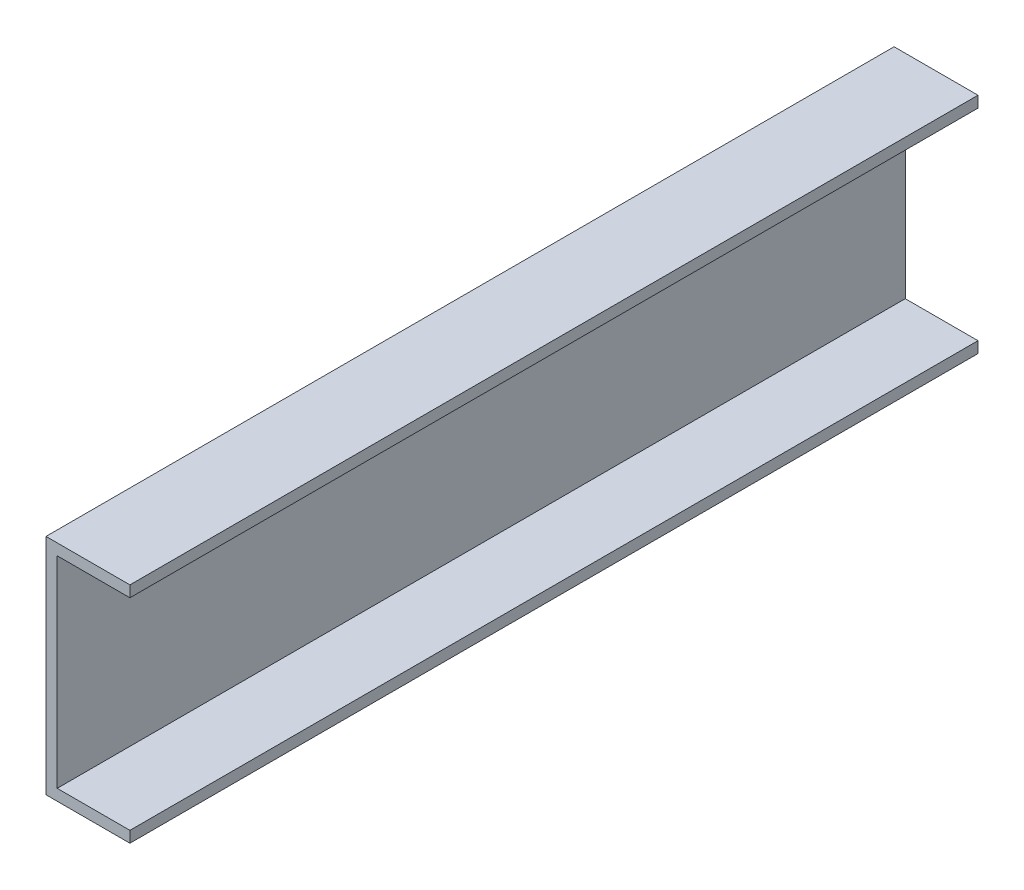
SolidWorks part; units mm, degrees
ref_plane "Front Plane" through (0, 0, 0) normal (0, 0, 1) x (1, 0, 0)
ref_plane "Top Plane" through (0, 0, 0) normal (0, 1, 0) x (1, 0, 0)
ref_plane "Right Plane" through (0, 0, 0) normal (1, 0, 0) x (0, 0, -1)
sketch "Sketch1" plane through (0, 0, 0) normal (0, 0, 1) x (1, 0, 0)
  line L0 (75, 0) -> (0, 0)
  line L1 (0, 0) -> (0, 200)
  line L2 (0, 200) -> (75, 200)
  line L3 (75, 200) -> (75, 190)
  line L4 (75, 190) -> (10, 190)
  line L5 (10, 190) -> (10, 10)
  line L6 (10, 10) -> (75, 10)
  line L7 (75, 10) -> (75, 0)
  dimension "D1" = 200
  dimension "D2" = 75
  dimension "D3" = 10
  dimension "D4" = 10
extrude "Boss-Extrude1" add sketch "Sketch1" along normal mid plane 758
